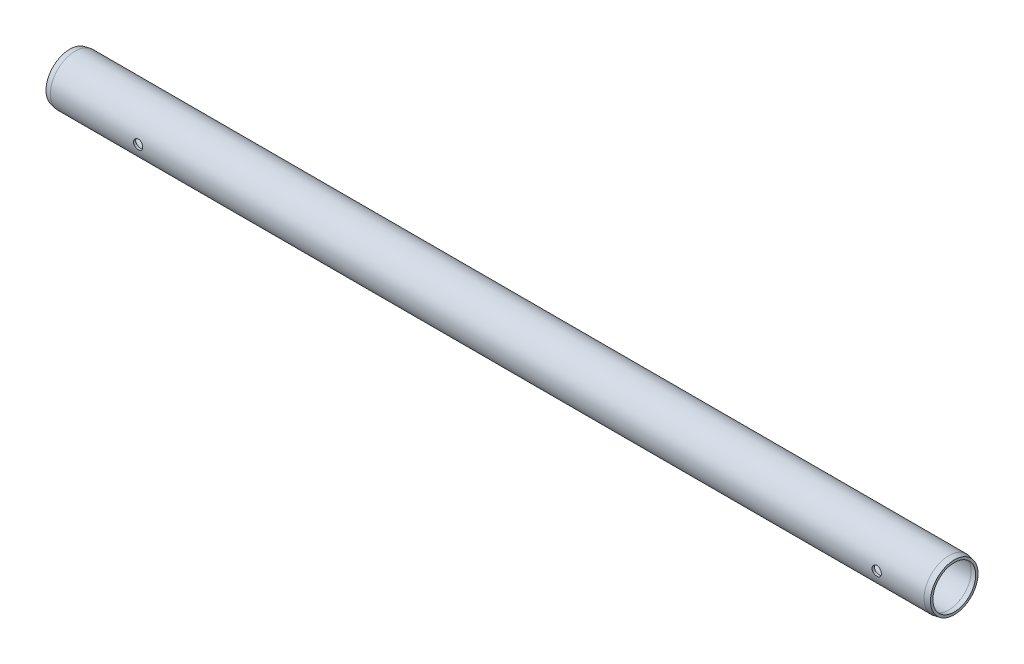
SolidWorks part; units mm, degrees
ref_plane "Plan de face" through (0, 0, 0) normal (0, 0, 1) x (1, 0, 0)
ref_plane "Plan de dessus" through (0, 0, 0) normal (0, 1, 0) x (1, 0, 0)
ref_plane "Plan de droite" through (0, 0, 0) normal (1, 0, 0) x (0, 0, -1)
sketch "Esquisse1" plane through (0, 0, 0) normal (0, 0, 1) x (1, 0, 0)
  line L0 (0, 0) -> (7.9375, 0) construction
  line L1 (1.8141, 7.25) -> (142.5, 7.25)
  line L2 (0, 7.6575) -> (1.741, 8)
  line L3 (1.741, 8) -> (142.5, 8)
  line L4 (142.5, 7.25) -> (142.5, 8)
  line L5 (0.0006, 6.8933) -> (1.8141, 7.25)
  line L6 (0, 7.6575) -> (0.0006, 6.8933)
  dimension "D2" = 7.25
  dimension "D3" = 8
  dimension "D4" = 0.75
revolve "Révolution1" add sketch "Esquisse1" angle 360 about L0
mirror "Symétrie1" about plane through (142.5, 7.25, 0) normal (-1, 0, 0)
sketch "Esquisse2" plane through (0, 0, 0) normal (0, 0, 1) x (1, 0, 0)
  line L0 (0, 7.6575) -> (0, -7.6575) construction
  line L1 (285, 7.6575) -> (285, -7.6575) construction
  circle A0 centre (30, 0) radius 1.5
  circle A1 centre (268, 0) radius 1.5
  dimension "D1" = 3
  dimension "D2" = 30
  dimension "D3" = 17
extrude "Enlèv. mat.-Extru.1" cut sketch "Esquisse2" against normal mid plane 30
